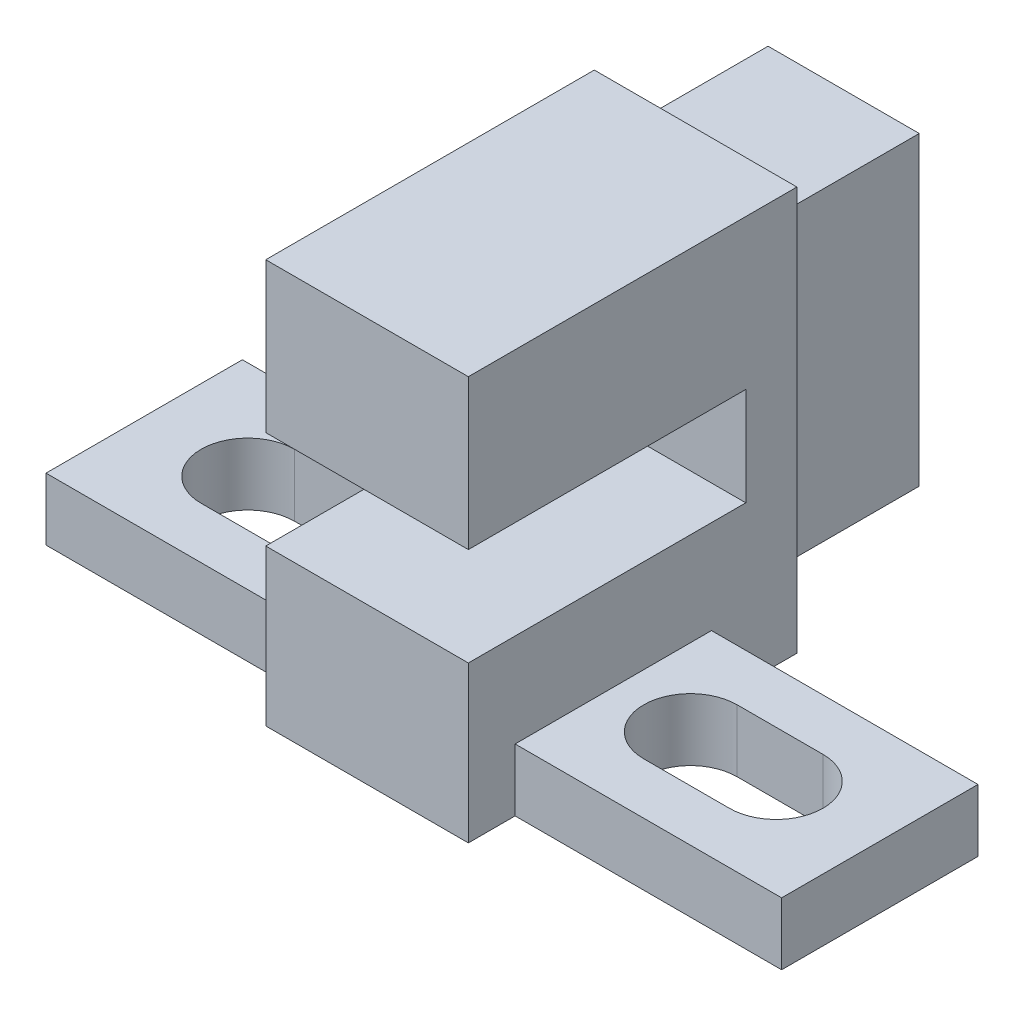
SolidWorks part; units mm, degrees
ref_plane "Front Plane" through (0, 0, 0) normal (0, 0, 1) x (1, 0, 0)
ref_plane "Top Plane" through (0, 0, 0) normal (0, 1, 0) x (1, 0, 0)
ref_plane "Right Plane" through (0, 0, 0) normal (1, 0, 0) x (0, 0, -1)
sketch "Sketch1" plane through (0, 0, 0) normal (1, 0, 0) x (0, 0, -1)
  line L1 (0, 0) -> (10.54, 0)
  line L2 (0, 0) -> (0, 12.954)
  line L3 (0, 12.954) -> (10.54, 12.954)
  line L4 (10.54, 0) -> (10.54, 12.954)
  dimension "D1" = 10.54
  dimension "D2" = 12.954
extrude "Boss-Extrude1" add sketch "Sketch1" along normal mid plane 6.5
sketch "Sketch2" plane through (3.25, 0, 0) normal (1, 0, 0) x (0, 0, -1)
  line L0 (0, 12.954) -> (0, 0) construction
  line L1 (0, 5) -> (8.9, 5)
  line L2 (0, 5) -> (0, 8.15)
  line L3 (0, 8.15) -> (8.9, 8.15)
  line L4 (8.9, 5) -> (8.9, 8.15)
  line L5 (0, 0) -> (10.54, 0) construction
  dimension "D1" = 3.15
  dimension "D2" = 8.9
  dimension "D3" = 5
extrude "Cut-Extrude1" cut sketch "Sketch2" against normal through all
sketch "Sketch3" plane through (0, 0, 0) normal (0, -1, 0) x (1, 0, 0)
  line L1 (0, 0) -> (0, -10.54) construction
  line L2 (-11.8, -7.8) -> (11.8, -7.8)
  line L3 (-11.8, -7.8) -> (-11.8, -1.5)
  line L4 (-11.8, -1.5) -> (11.8, -1.5)
  line L5 (11.8, -7.8) -> (11.8, -1.5)
  line L6 (-11.8, -7.8) -> (11.8, -1.5) construction
  line L7 (-11.8, -1.5) -> (11.8, -7.8) construction
  line L8 (3.25, 0) -> (-3.25, 0) construction
  point P0 (0, -4.65)
  dimension "D1" = 1.5
  dimension "D2" = 6.3
  dimension "D3" = 23.6
extrude "Boss-Extrude2" add sketch "Sketch3" against normal blind 2
sketch "Sketch4" plane through (0, 0, 0) normal (0, -1, 0) x (1, 0, 0)
  line L0 (-8.475, -4.65) -> (-5.725, -4.65) construction
  line L1 (-8.475, -3.15) -> (-5.725, -3.15)
  line L2 (-8.475, -6.15) -> (-5.725, -6.15)
  line L3 (5.725, -4.65) -> (8.475, -4.65) construction
  line L4 (5.725, -3.15) -> (8.475, -3.15)
  line L5 (5.725, -6.15) -> (8.475, -6.15)
  line L6 (-7.1, -4.65) -> (0, -4.65) construction
  line L7 (-7.1, -4.65) -> (-7.1, -7.8) construction
  line L8 (-11.8, -7.8) -> (-3.25, -7.8) construction
  line L9 (-7.1, -4.65) -> (-7.1, -1.5) construction
  line L10 (-3.25, -1.5) -> (-11.8, -1.5) construction
  line L11 (0, 0) -> (0, -10.54) construction
  line L12 (0, -4.65) -> (7.1, -4.65) construction
  arc A0 (-8.475, -3.15) -> (-8.475, -6.15) centre (-8.475, -4.65) ccw
  arc A1 (-5.725, -6.15) -> (-5.725, -3.15) centre (-5.725, -4.65) ccw
  arc A2 (5.725, -3.15) -> (5.725, -6.15) centre (5.725, -4.65) ccw
  arc A3 (8.475, -6.15) -> (8.475, -3.15) centre (8.475, -4.65) ccw
  point P2 (-7.1, -4.65)
  point P8 (7.1, -4.65)
  dimension "D2" = 1.5
  dimension "D3" = 2.75
  dimension "D1" = 3
  dimension "D4" = 2.75
  dimension "D6" = 7.1
extrude "Cut-Extrude2" cut sketch "Sketch4" against normal through all
sketch "Sketch5" plane through (0, 0, -10.54) normal (0, 0, -1) x (-1, 0, 0)
  line L0 (0, 0) -> (0, 12.954) construction
  line L1 (-2.425, 1.854) -> (2.425, 1.854)
  line L2 (-2.425, 1.854) -> (-2.425, 11.654)
  line L3 (-2.425, 11.654) -> (2.425, 11.654)
  line L4 (2.425, 1.854) -> (2.425, 11.654)
  line L5 (-2.425, 1.854) -> (2.425, 11.654) construction
  line L6 (-2.425, 11.654) -> (2.425, 1.854) construction
  line L7 (-3.25, 12.954) -> (3.25, 12.954) construction
  point P0 (0, 6.754)
  dimension "D1" = 4.85
  dimension "D2" = 9.8
  dimension "D3" = 1.3
extrude "Boss-Extrude3" add sketch "Sketch5" along normal blind 4.75
